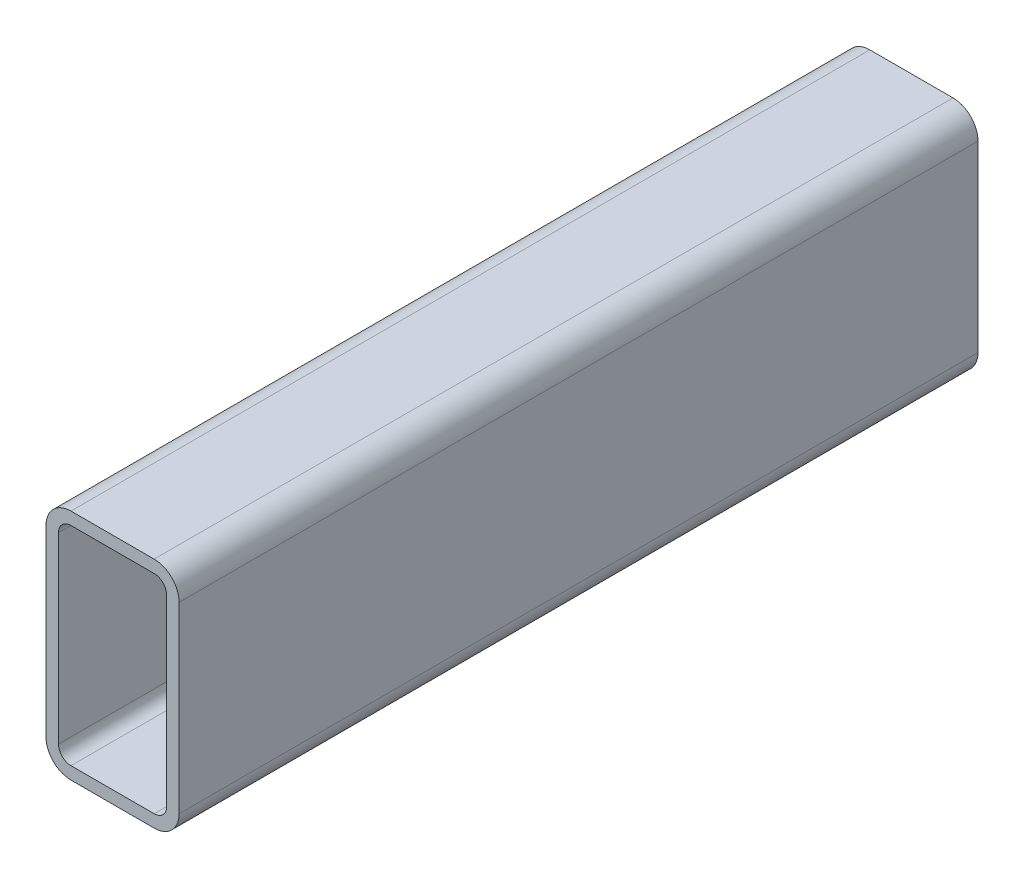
SolidWorks part; units mm, degrees
ref_plane "Front Plane" through (0, 0, 0) normal (0, 0, 1) x (1, 0, 0)
ref_plane "Top Plane" through (0, 0, 0) normal (0, 1, 0) x (1, 0, 0)
ref_plane "Right Plane" through (0, 0, 0) normal (1, 0, 0) x (0, 0, -1)
sketch "Sketch1" plane through (0, 0, 0) normal (0, 0, 1) x (1, 0, 0)
  line B0 (9.525, 88.9) -> (41.275, 88.9)
  arc B1 (50.8, 79.375) -> (41.275, 88.9) centre (41.275, 79.375) ccw
  line B2 (50.8, 79.375) -> (50.8, 9.525)
  arc B3 (41.275, 0) -> (50.8, 9.525) centre (41.275, 9.525) ccw
  line B4 (41.275, 0) -> (9.525, 0)
  arc B5 (0, 9.525) -> (9.525, 0) centre (9.525, 9.525) ccw
  line B6 (0, 9.525) -> (0, 79.375)
  arc B7 (9.525, 88.9) -> (0, 79.375) centre (9.525, 79.375) ccw
  line B8 (9.525, 84.1375) -> (41.275, 84.1375)
  arc B9 (46.0375, 79.375) -> (41.275, 84.1375) centre (41.275, 79.375) ccw
  line B10 (46.0375, 79.375) -> (46.0375, 9.525)
  arc B11 (41.275, 4.7625) -> (46.0375, 9.525) centre (41.275, 9.525) ccw
  line B12 (41.275, 4.7625) -> (9.525, 4.7625)
  arc B13 (4.7625, 9.525) -> (9.525, 4.7625) centre (9.525, 9.525) ccw
  line B14 (4.7625, 9.525) -> (4.7625, 79.375)
  arc B15 (9.525, 84.1375) -> (4.7625, 79.375) centre (9.525, 79.375) ccw
sketch_block_instance "HSS3.5x2x0.1875-1"
sketch_block "HSS3.5x2x0.1875"
extrude "Boss-Extrude1" add sketch "Sketch1" along normal blind 304.8
